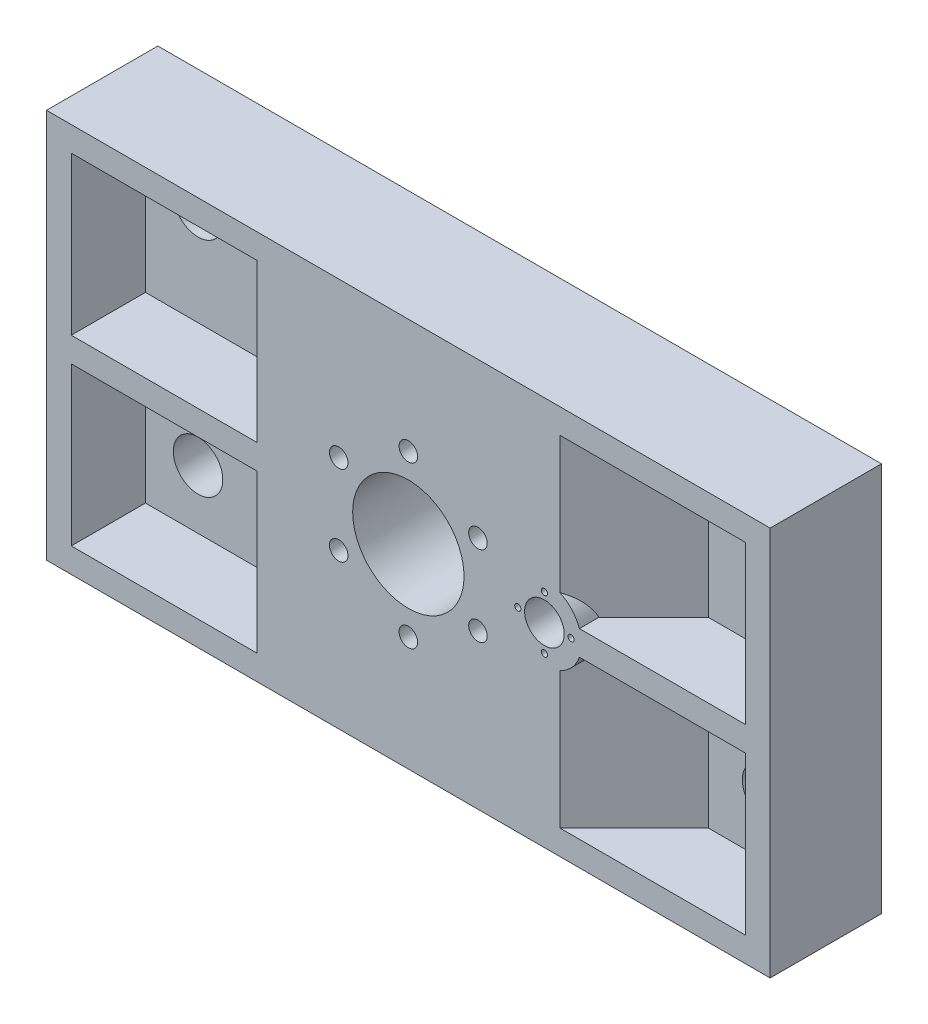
SolidWorks part; units mm, degrees
ref_plane "前视基准面" through (0, 0, 0) normal (0, 0, 1) x (1, 0, 0)
ref_plane "上视基准面" through (0, 0, 0) normal (0, 1, 0) x (1, 0, 0)
ref_plane "右视基准面" through (0, 0, 0) normal (1, 0, 0) x (0, 0, -1)
sketch "草图1" plane through (0, 0, 0) normal (0, 0, 1) x (1, 0, 0)
  line L0 (0, 0) -> (0, -65) construction
  line L1 (292.5, 157.5) -> (-292.5, 157.5)
  line L2 (292.5, 157.5) -> (292.5, -157.5)
  line L3 (292.5, -157.5) -> (-292.5, -157.5)
  line L4 (-292.5, 157.5) -> (-292.5, -157.5)
  line L5 (292.5, 157.5) -> (-292.5, -157.5) construction
  line L6 (292.5, -157.5) -> (-292.5, 157.5) construction
  line L7 (0, 0) -> (-230, 0) construction
  line L8 (-230, 0) -> (-230, -90) construction
  line L9 (0, 0) -> (110, 0) construction
  line L10 (110, 0) -> (131.5, 0) construction
  line L11 (110, 0) -> (110, -21.5) construction
  circle A0 centre (0, 0) radius 45
  circle A1 centre (0, -65) radius 7.5
  circle A2 centre (-56.2917, -32.5) radius 7.5
  circle A3 centre (-56.2917, 32.5) radius 7.5
  circle A4 centre (0, 65) radius 7.5
  circle A5 centre (56.2917, 32.5) radius 7.5
  circle A6 centre (56.2917, -32.5) radius 7.5
  circle A7 centre (-230, -90) radius 20
  circle A8 centre (-230, 90) radius 20
  circle A9 centre (230, -90) radius 20
  circle A10 centre (230, 90) radius 20
  circle A11 centre (110, 0) radius 16
  circle A12 centre (110, -21.5) radius 2.5
  circle A13 centre (131.5, 0) radius 2.5
  circle A14 centre (88.5, 0) radius 2.5
  circle A15 centre (110, 21.5) radius 2.5
  point P0 (0, 0)
  point P22 (0, 0)
  dimension "D3" = 6
  dimension "D1" = 585
  dimension "D2" = 315
extrude "凸台-拉伸1" add sketch "草图1" along normal blind 90
sketch "草图2" plane through (0, 0, 90) normal (0, 0, 1) x (1, 0, 0)
  line L0 (-230, 90) -> (-272.5, 90) construction
  line L1 (-272.5, 10) -> (-272.5, 137.5)
  line L2 (-272.5, 137.5) -> (-182.5, 137.5)
  line L3 (-182.5, 137.5) -> (-182.5, 10)
  line L4 (-182.5, 10) -> (-272.5, 10)
  line L5 (0, 0) -> (-133.7979, 0) construction
  line L6 (0, 0) -> (0, -112.2077) construction
  line L7 (-182.5, -10) -> (-272.5, -10)
  line L8 (-182.5, -137.5) -> (-182.5, -10)
  line L9 (-272.5, -137.5) -> (-182.5, -137.5)
  line L10 (-272.5, -10) -> (-272.5, -137.5)
  line L11 (272.5, -137.5) -> (182.5, -137.5)
  line L12 (182.5, -137.5) -> (182.5, -10)
  line L13 (272.5, -10) -> (272.5, -137.5)
  line L14 (182.5, -10) -> (272.5, -10)
  line L15 (182.5, 10) -> (272.5, 10)
  line L16 (272.5, 137.5) -> (182.5, 137.5)
  line L17 (182.5, 137.5) -> (182.5, 10)
  line L18 (272.5, 10) -> (272.5, 137.5)
extrude "切除-拉伸1" cut sketch "草图2" against normal blind 60
sketch "草图3" plane through (0, -10, 0) normal (0, -1, 0) x (1, 0, 0)
  line L2 (-182.5, 30) -> (-122.5, 90)
  line L3 (-182.5, 90) -> (-272.5, 90) construction
  line L4 (-122.5, 90) -> (-182.5, 90)
  line L5 (-182.5, 30) -> (-182.5, 90) construction
  line L6 (-182.5, 30) -> (-182.5, 90)
extrude "切除-拉伸2" cut sketch "草图3" along normal up to surface (127.5 mm away)
sketch "草图4" plane through (0, 137.5, 0) normal (0, -1, 0) x (1, 0, 0)
  line L0 (-122.5, 90) -> (-272.5, 90) construction
  line L1 (-182.5, 30) -> (-182.5, 90) construction
  line L2 (-182.5, 30) -> (-122.5, 90) construction
  line L3 (-122.5, 90) -> (-182.5, 90)
  line L4 (-182.5, 30) -> (-182.5, 90)
  line L5 (-182.5, 30) -> (-122.5, 90)
extrude "切除-拉伸3" cut sketch "草图4" along normal up to surface (127.5 mm away)
sketch "草图5" plane through (0, -10, 0) normal (0, -1, 0) x (1, 0, 0)
  line L0 (182.5, 30) -> (182.5, 90) construction
  line L1 (272.5, 90) -> (182.5, 90) construction
  line L2 (182.5, 30) -> (182.5, 90)
  line L3 (182.5, 90) -> (122.5, 90)
  line L4 (182.5, 30) -> (122.5, 90)
extrude "切除-拉伸4" cut sketch "草图5" along normal up to surface (127.5 mm away)
sketch "草图6" plane through (0, 137.5, 0) normal (0, -1, 0) x (1, 0, 0)
  line L0 (272.5, 90) -> (122.5, 90) construction
  line L1 (122.5, 90) -> (182.5, 30) construction
  line L2 (182.5, 30) -> (182.5, 90) construction
  line L3 (182.5, 90) -> (122.5, 90)
  line L4 (122.5, 90) -> (182.5, 30)
  line L5 (182.5, 30) -> (182.5, 90)
extrude "切除-拉伸5" cut sketch "草图6" along normal up to surface (127.5 mm away)
sketch "草图7" plane through (0, 0, 90) normal (0, 0, 1) x (1, 0, 0)
  line L0 (122.5, 10) -> (122.5, 137.5) construction
  line L1 (122.5, 10) -> (272.5, 10) construction
  line L2 (272.5, -10) -> (122.5, -10) construction
  line L3 (122.5, -137.5) -> (122.5, -10) construction
  line L4 (122.5, 10) -> (122.5, 27.2718)
  line L5 (122.5, 10) -> (138.2843, 10)
  line L6 (138.2843, -10) -> (122.5, -10)
  line L7 (122.5, -27.2718) -> (122.5, -10)
  arc A0 (122.5, -27.2718) -> (138.2843, -10) centre (110, 0) ccw
  arc A1 (138.2843, 10) -> (122.5, 27.2718) centre (110, 0) ccw
extrude "凸台-拉伸2" add sketch "草图7" against normal up to surface
sketch "草图8" plane through (0, 0, 0) normal (0, 0, -1) x (-1, 0, 0)
  line L0 (-102.5, -29.0474) -> (-102.5, -137.5)
  line L1 (102.5, 137.5) -> (-102.5, 137.5)
  line L2 (102.5, 137.5) -> (102.5, -137.5)
  line L3 (102.5, -137.5) -> (-102.5, -137.5)
  line L4 (-102.5, 137.5) -> (-102.5, 29.0474)
  line L5 (102.5, 137.5) -> (-102.5, -137.5) construction
  line L6 (102.5, -137.5) -> (-102.5, 137.5) construction
  arc A0 (-102.5, -29.0474) -> (-102.5, 29.0474) centre (-110, 0) ccw
  point P0 (0, 0)
  dimension "D1" = 205
  dimension "D2" = 275
extrude "切除-拉伸6" cut sketch "草图8" against normal blind 60
sketch "草图9" plane through (0, 0, 60) normal (0, 0, -1) x (-1, 0, 0)
  line L0 (-102.5, -137.5) -> (102.5, -137.5) construction
  line L1 (102.5, -137.5) -> (102.5, 137.5) construction
  line L2 (10, 137.5) -> (10, 79.3725)
  line L3 (102.5, 10) -> (79.3725, 10)
  line L4 (-10, 137.5) -> (-10, 79.3725)
  line L5 (10, 168.279) -> (-10, -168.279) construction
  line L6 (10, -168.279) -> (-10, 168.279) construction
  line L7 (102.5, 137.5) -> (-102.5, 137.5) construction
  line L8 (-10, -137.5) -> (10, -137.5)
  line L9 (10, 137.5) -> (-10, 137.5)
  line L10 (-10, -79.3725) -> (-10, -137.5)
  line L11 (10, -79.3725) -> (10, -137.5)
  line L13 (102.5, -10) -> (79.3725, -10)
  line L15 (158.0871, 10) -> (-158.0871, -10) construction
  line L16 (158.0871, -10) -> (-158.0871, 10) construction
  line L17 (102.5, -10) -> (102.5, 10)
  line L18 (0.5943, 10) -> (-0.5943, 10)
  line L19 (0.5943, -10) -> (-0.5943, -10)
  line L20 (-79.3725, -10) -> (-81.7157, -10)
  line L21 (-79.3725, 10) -> (-81.7157, 10)
  arc A0 (-10, 79.3725) -> (-79.3725, 10) centre (0, 0) ccw
  circle A1 centre (-56.2917, -32.5) radius 7.5 construction
  circle A2 centre (0, -65) radius 7.5 construction
  circle A3 centre (56.2917, -32.5) radius 7.5 construction
  circle A4 centre (56.2917, 32.5) radius 7.5 construction
  circle A5 centre (0, 65) radius 7.5 construction
  circle A6 centre (-56.2917, 32.5) radius 7.5 construction
  circle A8 centre (-56.2917, -32.5) radius 7.5
  circle A9 centre (0, -65) radius 7.5
  circle A10 centre (56.2917, -32.5) radius 7.5
  circle A11 centre (56.2917, 32.5) radius 7.5
  circle A12 centre (0, 65) radius 7.5
  circle A13 centre (-56.2917, 32.5) radius 7.5
  circle A14 centre (0, 0) radius 45 construction
  circle A15 centre (0, 0) radius 45
  arc A16 (10, -79.3725) -> (79.3725, -10) centre (0, 0) ccw
  arc A17 (-102.5, -29.0474) -> (-102.5, 29.0474) centre (-110, 0) ccw construction
  arc A18 (-81.7157, -10) -> (-81.7157, 10) centre (-110, 0) ccw
  arc A19 (79.3725, 10) -> (10, 79.3725) centre (0, 0) ccw
  arc A21 (-79.3725, -10) -> (-10, -79.3725) centre (0, 0) ccw
  dimension "D1" = 20
  dimension "D2" = 20
extrude "凸台-拉伸7" add sketch "草图9" along normal blind 40 contours L20 A21 L10 L11 A16 L13 L3 A19 L2 L4 A0 L21 M8 M9 M10 M12 M2 M4 M6 M7 M5 M3 M1
sketch "草图11" plane through (0, -10, 0) normal (0, -1, 0) x (1, 0, 0)
  line L0 (-102.5, 20) -> (-102.5, 60) construction
  line L1 (-102.5, 0) -> (-102.5, 60)
  line L2 (-102.5, 60) -> (-162.5, 0)
  line L4 (-102.5, 0) -> (102.5, 0) construction
  line L5 (-162.5, 0) -> (-102.5, 0)
  line L6 (0, -11.2612) -> (0, 34.6606) construction
  line L7 (102.5, 0) -> (102.5, 60)
  line L8 (102.5, 60) -> (162.5, 0)
  line L9 (162.5, 0) -> (102.5, 0)
extrude "切除-拉伸8" cut sketch "草图11" along normal up to surface (127.5 mm away)
sketch "草图12" plane through (0, 137.5, 0) normal (0, -1, 0) x (1, 0, 0)
  line L0 (102.5, 60) -> (102.5, 0) construction
  line L1 (162.5, 0) -> (122.49, 40.01) construction
  line L2 (122.49, 0) -> (162.5, 0) construction
  line L3 (-102.5, 60) -> (-102.5, 0) construction
  line L4 (-102.5, 60) -> (-162.5, 0) construction
  line L5 (-162.5, 0) -> (-102.5, 0) construction
  line L6 (102.5, 60) -> (102.5, 0)
  line L7 (162.5, 0) -> (102.5, 60)
  line L8 (102.5, 0) -> (162.5, 0)
  line L9 (-102.5, 60) -> (-102.5, 0)
  line L10 (-102.5, 60) -> (-162.5, 0)
  line L11 (-162.5, 0) -> (-102.5, 0)
extrude "切除-拉伸9" cut sketch "草图12" along normal up to surface (127.5 mm away)
sketch "草图13" plane through (0, -10, 0) normal (0, -1, 0) x (1, 0, 0)
  line L0 (-102.5, 60) -> (-162.5, 0) construction
  line L1 (-102.5, 20) -> (-79.3725, 20) construction
  line L2 (-142.5, 20) -> (-162.5, 0)
  line L3 (-142.5, 20) -> (-102.5, 20)
  line L4 (-102.5, 0) -> (-102.5, 20) construction
  line L5 (-162.5, 0) -> (-102.5, 0) construction
  line L6 (-102.5, 0) -> (-102.5, 20)
  line L7 (-162.5, 0) -> (-102.5, 0)
  line L8 (0, 0) -> (0, 31.7605) construction
  line L9 (142.5, 20) -> (162.5, 0)
  line L11 (142.5, 20) -> (81.7157, 20)
  line L12 (162.5, 0) -> (81.7157, 0)
  line L14 (81.7157, 20) -> (81.7157, 60) construction
  line L16 (81.7157, 0) -> (81.7157, 20)
extrude "切除-拉伸16" cut sketch "草图13" against normal blind 55 and the other way blind 48
sketch "草图15" plane through (81.7157, 0, 0) normal (1, 0, 0) x (0, 0, -1)
  line L4 (-20, -10) -> (0, -10)
  line L5 (0, -10) -> (0, 10)
  line L6 (0, 10) -> (-20, 10)
  line L7 (-20, 10) -> (-20, -10)
  line L8 (-20, -10) -> (0, -10)
  line L9 (0, -10) -> (0, 10)
  line L10 (0, 10) -> (-20, 10)
  line L11 (-20, 10) -> (-20, -10)
  dimension "D1" = 0
extrude "切除-拉伸17" cut sketch "草图15" against normal blind 2
sketch "草图16" plane through (0, 0, 20) normal (0, 0, -1) x (-1, 0, 0)
  line L0 (-122.49, 10) -> (-142.5, 10) construction
  line L1 (-142.5, -10) -> (-122.49, -10) construction
  line L2 (-102.5, -29.0474) -> (-102.5, -14.1333) construction
  line L3 (-102.5, 14.1333) -> (-102.5, 29.0474) construction
  line L4 (-122.49, 10) -> (-138.2843, 10)
  line L5 (-138.2843, -10) -> (-122.49, -10)
  line L6 (-102.5, -29.0474) -> (-102.5, -14.1333)
  line L7 (-102.5, 14.1333) -> (-102.5, 29.0474)
  circle A0 centre (-110, 0) radius 16 construction
  arc A1 (-102.5, 14.1333) -> (-122.49, 10) centre (-110, 0) ccw
  arc A2 (-138.2843, -10) -> (-102.5, -29.0474) centre (-110, 0) ccw
  circle A3 centre (-110, -21.5) radius 2.5 construction
  circle A4 centre (-110, 21.5) radius 2.5 construction
  circle A5 centre (-110, -21.5) radius 2.5
  circle A6 centre (-110, 21.5) radius 2.5
  arc A7 (-102.5, 29.0474) -> (-138.2843, 10) centre (-110, 0) ccw
  arc A8 (-122.49, -10) -> (-102.5, -14.1333) centre (-110, 0) ccw
extrude "凸台-拉伸8" add sketch "草图16" against normal up to surface (35 mm away)
sketch "草图17" plane through (0, 0, 20) normal (0, 0, -1) x (-1, 0, 0)
  circle A0 centre (56.2917, -32.5) radius 12.5
  circle A1 centre (0, -65) radius 12.5
  circle A2 centre (-56.2917, -32.5) radius 12.5
  circle A3 centre (-56.2917, 32.5) radius 12.5
  circle A4 centre (0, 65) radius 12.5
  circle A5 centre (56.2917, 32.5) radius 12.5
extrude "切除-拉伸18" cut sketch "草图17" against normal blind 20
